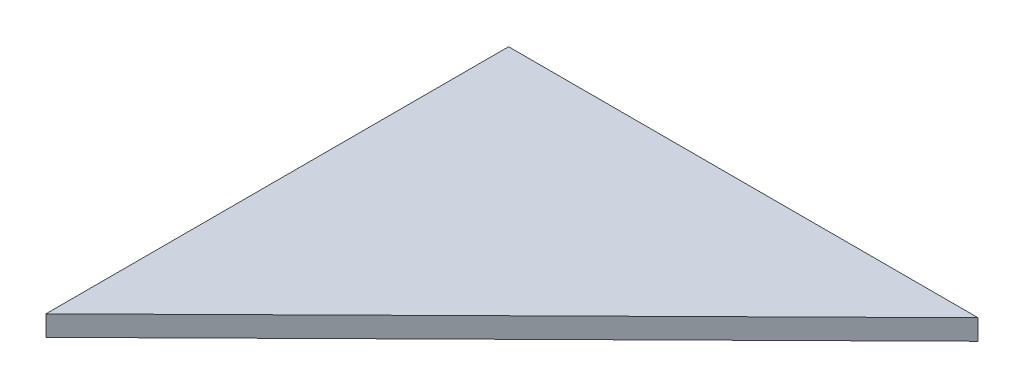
SolidWorks part; units mm, degrees
ref_plane "Plan de face" through (0, 0, 0) normal (0, 0, 1) x (1, 0, 0)
ref_plane "Plan de dessus" through (0, 0, 0) normal (0, 1, 0) x (1, 0, 0)
ref_plane "Plan de droite" through (0, 0, 0) normal (1, 0, 0) x (0, 0, -1)
sketch "Esquisse1" plane through (0, 0, 0) normal (0, 1, 0) x (1, 0, 0)
  line L0 (0, 0) -> (0, -68)
  line L1 (0, -68) -> (69, 0)
  line L2 (69, 0) -> (0, 0)
  dimension "D1" = 69
  dimension "D2" = 68
extrude "Extrusion1" add sketch "Esquisse1" along normal blind 3
